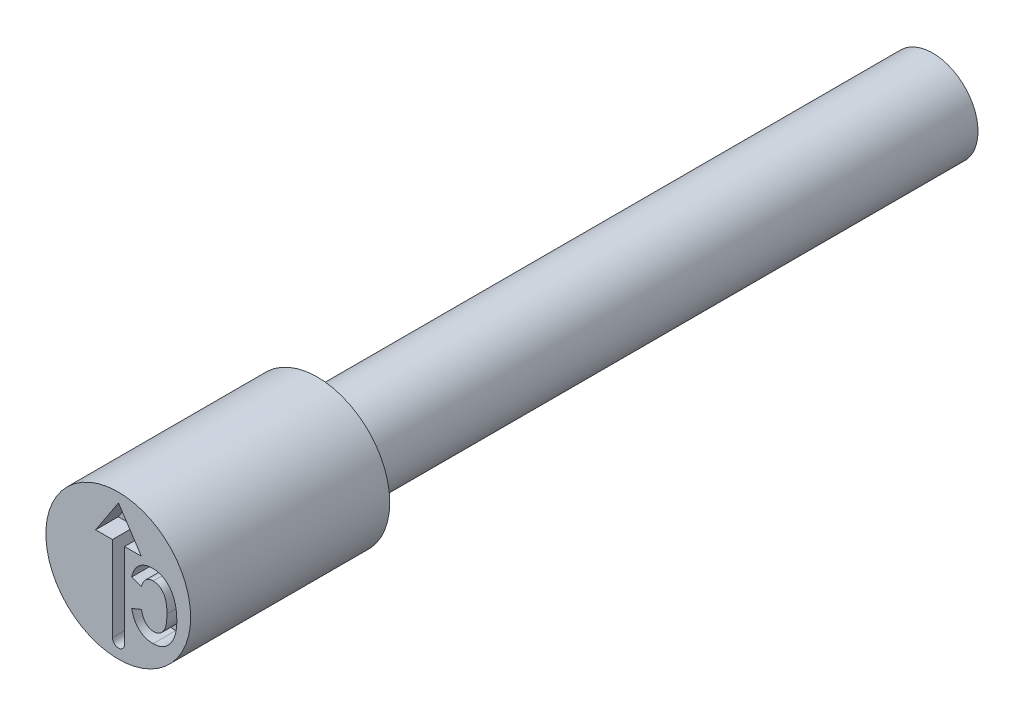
SolidWorks part; units mm, degrees
ref_plane "Front Plane" through (0, 0, 0) normal (0, 0, 1) x (1, 0, 0)
ref_plane "Top Plane" through (0, 0, 0) normal (0, 1, 0) x (1, 0, 0)
ref_plane "Right Plane" through (0, 0, 0) normal (1, 0, 0) x (0, 0, -1)
sketch "Sketch2" plane through (0, 0, 0) normal (1, 0, 0) x (0, 0, -1)
  line L0 (0.4039, 0) -> (50000.4039, 0) construction
  line L6 (0, 0.8) -> (0, 0)
  line L7 (2.2, 0.8) -> (0, 0.8)
  line L8 (2.2, 0.5) -> (2.2, 0.8)
  line L9 (9, 0.5) -> (2.2, 0.5)
  line L10 (9, 0) -> (9, 0.5)
  line L11 (0, 0) -> (9, 0)
  dimension "D1" = 1.6
  dimension "D2" = 1
  dimension "D3" = 9
  dimension "D4" = 2.2
revolve "Revolve1" add sketch "Sketch2" angle 360 about L0
sketch "Sketch3" plane through (0, 0, 0) normal (0, 0, 1) x (1, 0, 0)
  line L0 (0.0025, -0.0048) -> (0.0025, 34999.9952) construction
  line L1 (0.0692, 0.3124) -> (0.0692, -0.6265)
  line L2 (0.2552, 0.3124) -> (0.0692, 0.3124)
  line L3 (0.0025, 0.6959) -> (0.2552, 0.3124)
  line L4 (0.0025, 0.6959) -> (-0.2502, 0.3124)
  line L5 (-0.2502, 0.3124) -> (-0.0642, 0.3124)
  line L6 (-0.0642, 0.3124) -> (-0.0642, -0.6265)
  arc A0 (-0.0642, -0.6265) -> (0.0692, -0.6265) centre (0.0025, -0.6265) ccw
extrude "Cut-Extrude4" cut sketch "Sketch3" against normal blind 0.25
sketch "Sketch4" plane through (0, 0, 0) normal (0, 0, 1) x (1, 0, 0)
  text T0 "C" font "Arial Narrow" height 0.7
  dimension "D1" = 0.45
extrude "Cut-Extrude5" cut sketch "Sketch4" against normal blind 0.25
